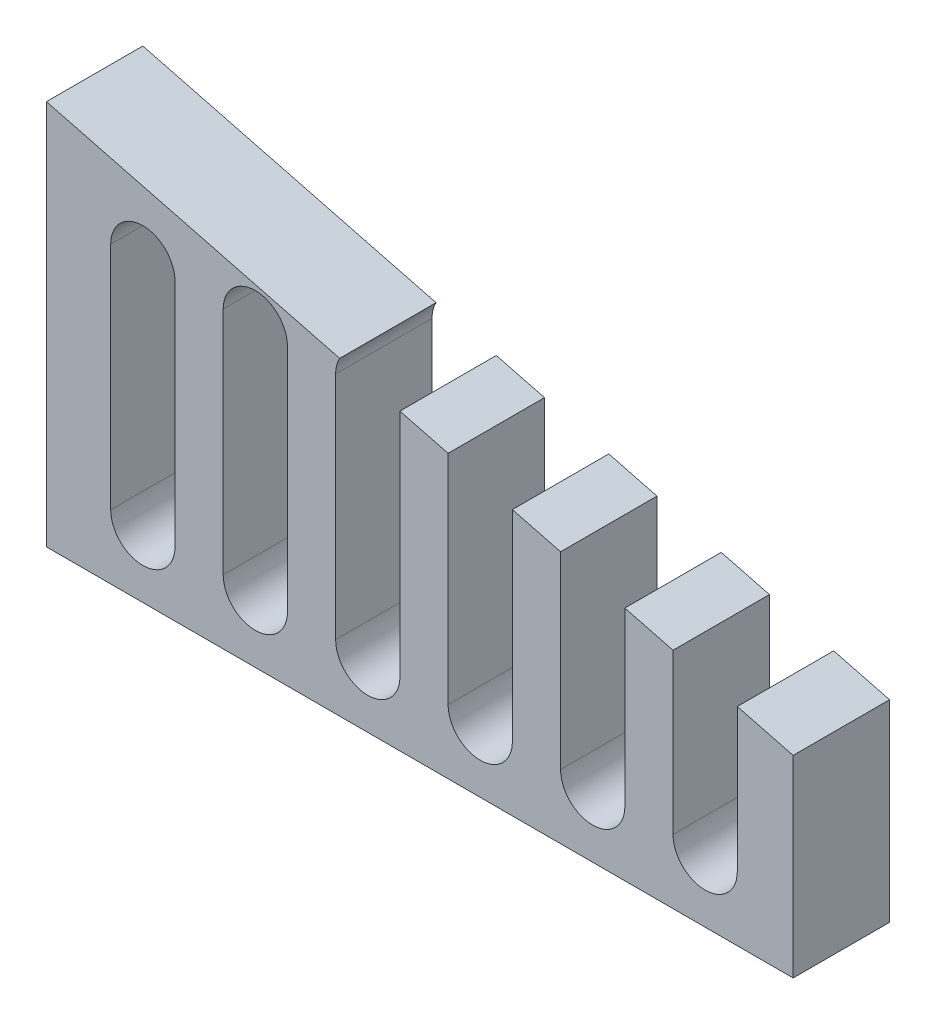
SolidWorks part; units mm, degrees
ref_plane "Front Plane" through (0, 0, 0) normal (0, 0, 1) x (1, 0, 0)
ref_plane "Top Plane" through (0, 0, 0) normal (0, 1, 0) x (1, 0, 0)
ref_plane "Right Plane" through (0, 0, 0) normal (1, 0, 0) x (0, 0, -1)
sketch "Sketch1" plane through (0, 0, 0) normal (0, 0, -1) x (1, 0, 0)
  line L1 (0, -38.1) -> (73.7803, -19.05)
  line L2 (0, -38.1) -> (0, 0)
  line L3 (0, 0) -> (73.7803, 0)
  line L4 (73.7803, -19.05) -> (73.7803, 0)
  dimension "D1" = 76.2
  dimension "D2" = 38.1
  dimension "D3" = 19.05
extrude "Extrude1" add sketch "Sketch1" along normal blind 9.525
sketch "Sketch2" plane through (0, 0, -9.525) normal (0, 0, -1) x (1, 0, 0)
  line L2 (73.7803, -3.175) -> (0, -3.175)
  line L3 (73.7803, -3.175) -> (0, -3.175) construction
  line L4 (6.35, -6.35) -> (6.35, -29.0824)
  line L5 (-0.7937, -35.0258) -> (72.9866, -15.9758)
  line L6 (0, -34.8209) -> (73.7803, -15.7709) construction
  line L7 (12.7, -6.35) -> (12.7, -29.0824)
  line L8 (0, 0) -> (0, -38.1) construction
  line L9 (73.7803, -19.05) -> (73.7803, 0) construction
  line L10 (0, 0) -> (0, -38.1) construction
  arc A0 (6.35, -6.35) -> (12.7, -6.35) centre (9.525, -6.35) cw
  arc A1 (12.7, -29.0824) -> (6.35, -29.0824) centre (9.525, -29.0824) cw
  dimension "D3" = 9.525
  dimension "D4" = 6.35
  dimension "offset" = 3.175
extrude "Cut-Extrude1" cut sketch "Sketch2" against normal through all
pattern_linear "LPattern1" count 6 spacing 11.1125 along (1, 0, 0) of "Cut-Extrude1"
